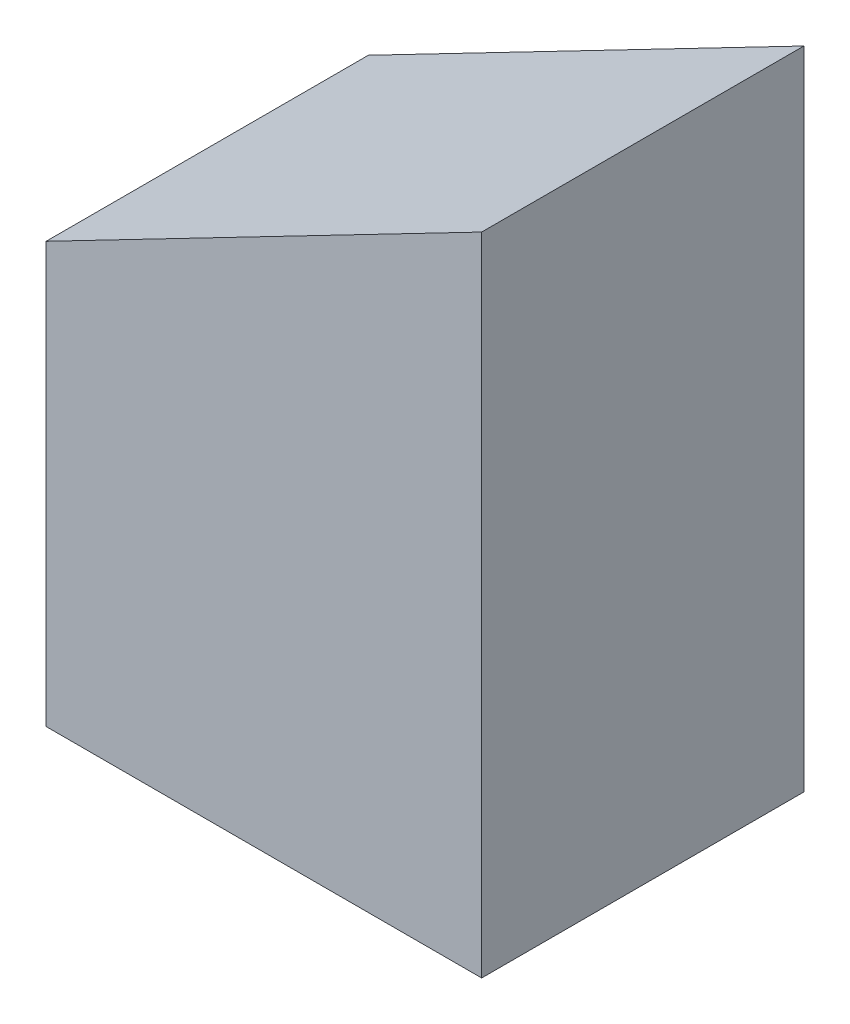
SolidWorks part; units mm, degrees
ref_plane "Front Plane" through (0, 0, 0) normal (0, 0, 1) x (1, 0, 0)
ref_plane "Top Plane" through (0, 0, 0) normal (0, 1, 0) x (1, 0, 0)
ref_plane "Right Plane" through (0, 0, 0) normal (1, 0, 0) x (0, 0, -1)
sketch "Sketch1" plane through (0, 0, 0) normal (0, 0, 1) x (1, 0, 0)
  line L0 (-26.0927, 0) -> (25.4061, 0)
  line L1 (25.4061, 0) -> (25.4061, 76.3831)
  line L2 (25.4061, 76.3831) -> (-26.0927, 49.6861)
  line L3 (-26.0927, 49.6861) -> (-26.0927, 0)
extrude "Extrude1" add sketch "Sketch1" along normal mid plane 38.1
